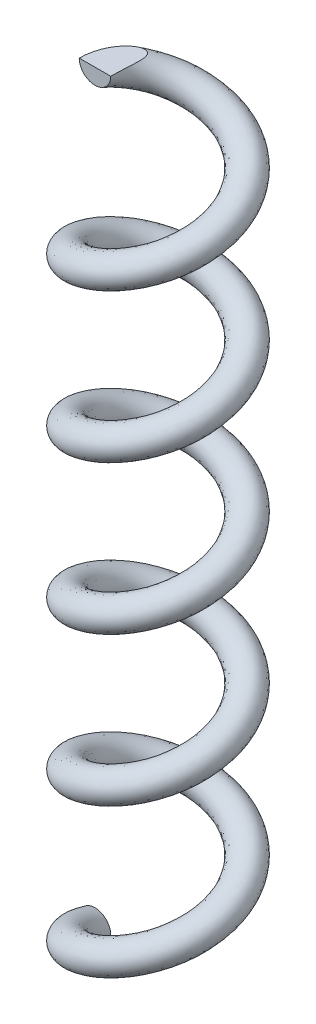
SolidWorks part; units mm, degrees
ref_plane "Front Plane" through (0, 0, 0) normal (0, 0, 1) x (1, 0, 0)
ref_plane "Top Plane" through (0, 0, 0) normal (0, 1, 0) x (1, 0, 0)
ref_plane "Right Plane" through (0, 0, 0) normal (1, 0, 0) x (0, 0, -1)
sketch "Sketch1" plane through (0, 0, 0) normal (0, 0, 1) x (1, 0, 0)
  line L1 (-24, -71.5) -> (-38, -71.5) construction
  circle A0 centre (-38, -71.5) radius 3.5
  dimension "D3" = 7
  dimension "D2" = 14
sketch "Sketch5" plane through (0, 0, 0) normal (0, 0, 1) x (1, 0, 0)
  line L0 (-24, -71.5) -> (-24, 93.7077)
  line L3 (-29, 93.7077) -> (-19, 93.7077) construction
sweep "Sweep3" add profiles "Sketch1" path "Sketch5" parameters "D4"=1800
ref_plane "Plane3" through (0, 93.7077, 0) normal (0, 1, 0) x (1, 0, 0)
ref_plane "Plane4" through (0, -71.5, 0) normal (0, 1, 0) x (1, 0, 0)
other "SurfaceCut1"
other "SurfaceCut2"
